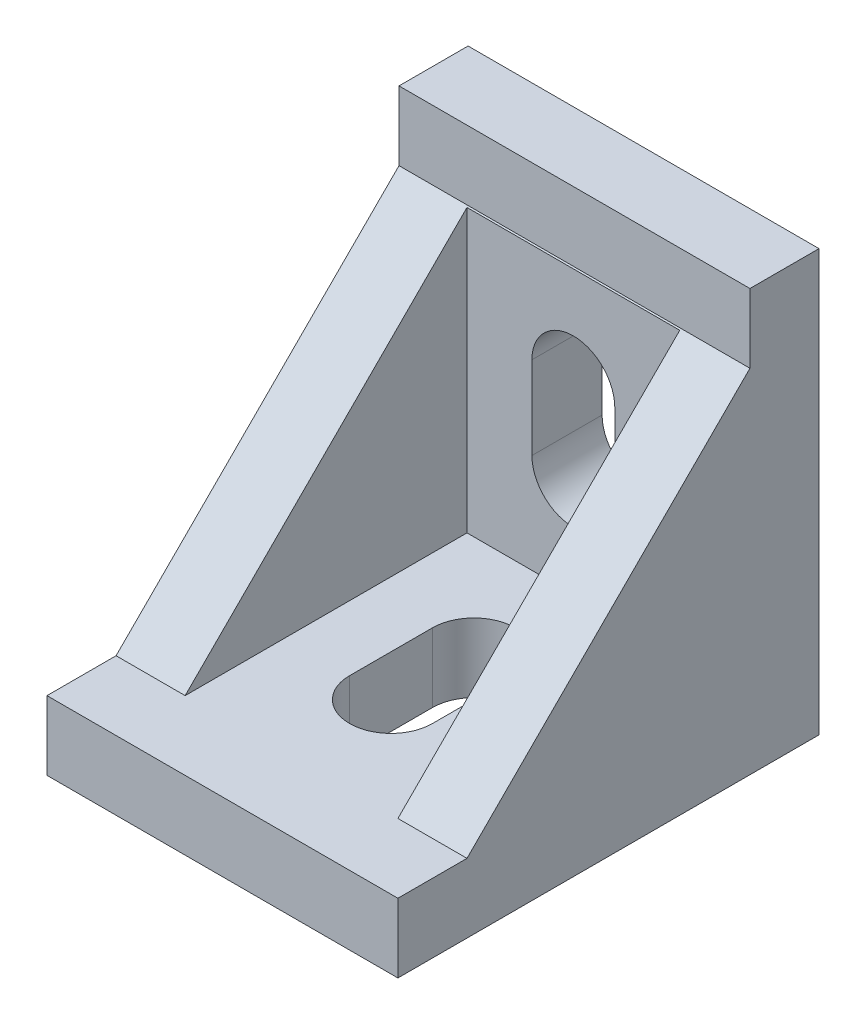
SolidWorks part; units mm, degrees
ref_plane "Front Plane" through (0, 0, 0) normal (0, 0, 1) x (1, 0, 0)
ref_plane "Top Plane" through (0, 0, 0) normal (0, 1, 0) x (1, 0, 0)
ref_plane "Right Plane" through (0, 0, 0) normal (1, 0, 0) x (0, 0, -1)
sketch "Sketch1" plane through (0, 0, 0) normal (1, 0, 0) x (0, 0, -1)
  line L0 (0, 0) -> (30.48, 0)
  line L1 (30.48, 0) -> (30.48, 30.48)
  line L2 (30.48, 30.48) -> (25.48, 30.48)
  line L3 (25.48, 30.48) -> (25.48, 25.48)
  line L4 (25.48, 25.48) -> (5, 5)
  line L5 (5, 5) -> (0, 5)
  line L6 (0, 5) -> (0, 0)
  dimension "D1" = 30.48
  dimension "D2" = 5
extrude "Boss-Extrude1" add sketch "Sketch1" along normal blind 25.4
sketch "Sketch2" plane through (0, 0, 0) normal (0, 0, 1) x (1, 0, 0)
  line L0 (25.4, 25.48) -> (0, 25.48) construction
  line L1 (5, 25.48) -> (20.4, 25.48)
  line L2 (5, 25.48) -> (5, 5)
  line L3 (5, 5) -> (20.4, 5)
  line L4 (20.4, 25.48) -> (20.4, 5)
  line L5 (25.4, 5) -> (0, 5) construction
  line L6 (0, 25.48) -> (0, 5) construction
  line L7 (25.4, 25.48) -> (25.4, 5) construction
  dimension "D1" = 5
  dimension "D2" = 5
extrude "Cut-Extrude1" cut sketch "Sketch2" against normal blind 25.4
sketch "Sketch3" plane through (0, 0, -25.4) normal (0, 0, 1) x (1, 0, 0)
  line L0 (12.7, 18.2) -> (12.7, 12.2) construction
  line L1 (15.7, 18.2) -> (15.7, 12.2)
  line L2 (9.7, 18.2) -> (9.7, 12.2)
  line L6 (5, 5) -> (5, 25.4) construction
  line L11 (5, 5) -> (20.4, 5) construction
  arc A0 (15.7, 18.2) -> (9.7, 18.2) centre (12.7, 18.2) ccw
  arc A1 (9.7, 12.2) -> (15.7, 12.2) centre (12.7, 12.2) ccw
  point P2 (12.7, 15.2)
  dimension "D1" = 3
  dimension "D2" = 7.7
  dimension "D3" = 6
  dimension "D4" = 10.2
extrude "Cut-Extrude2" cut sketch "Sketch3" against normal through all both and the other way through all
sketch "Sketch4" plane through (0, 5, 0) normal (0, 1, 0) x (1, 0, 0)
  line L0 (12.7, 18.2) -> (12.7, 12.2) construction
  line L1 (15.7, 18.2) -> (15.7, 12.2)
  line L2 (9.7, 18.2) -> (9.7, 12.2)
  line L3 (5, 5) -> (5, 25.4) construction
  line L4 (5, 5) -> (0, 5) construction
  arc A0 (15.7, 18.2) -> (9.7, 18.2) centre (12.7, 18.2) ccw
  arc A1 (9.7, 12.2) -> (15.7, 12.2) centre (12.7, 12.2) ccw
  point P2 (12.7, 15.2)
  dimension "D4" = 3
  dimension "D1" = 7.7
  dimension "D2" = 6
  dimension "D3" = 10.2
extrude "Cut-Extrude3" cut sketch "Sketch4" against normal through all both and the other way through all
